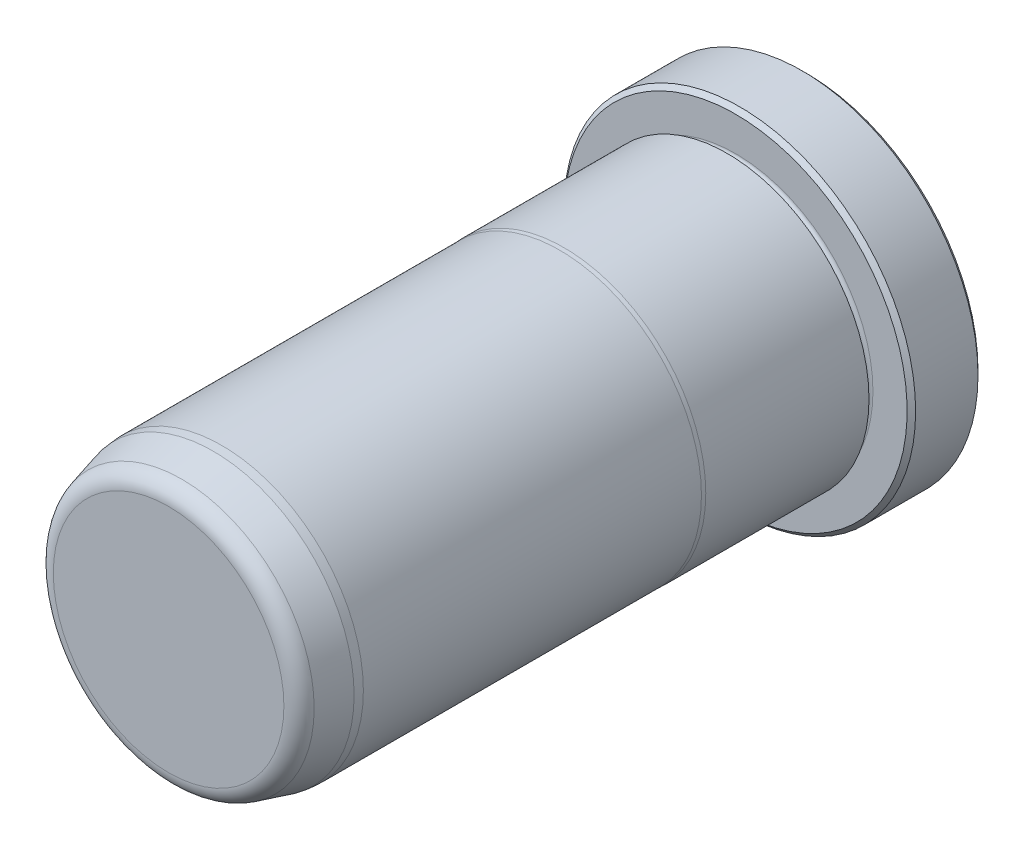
SolidWorks part; units mm, degrees
ref_plane "Front Plane" through (0, 0, 0) normal (0, 0, 1) x (1, 0, 0)
ref_plane "Top Plane" through (0, 0, 0) normal (0, 1, 0) x (1, 0, 0)
ref_plane "Right Plane" through (0, 0, 0) normal (1, 0, 0) x (0, 0, -1)
sketch "Sketch1" plane through (0, 0, 0) normal (1, 0, 0) x (0, 0, -1)
  line L0 (0, 0) -> (0, 15.748)
  line L1 (0, 15.748) -> (-6.35, 15.748)
  line L2 (-6.35, 15.748) -> (-6.35, 12.3063)
  line L3 (-6.35, 11.9253) -> (-7.112, 11.9253) construction
  line L4 (-7.112, 12.3063) -> (-7.112, 12.7127)
  line L5 (-7.112, 12.7127) -> (-21.7348, 12.7127)
  line L6 (-21.7348, 12.7127) -> (-22.098, 12.6873)
  line L7 (-22.098, 12.6873) -> (-52.3875, 12.6873)
  line L9 (-57.15, 11.5487) -> (-57.15, 0)
  line L10 (-57.15, 0) -> (0, 0)
  line L11 (0, 0) -> (13.6287, 0) construction
  line L12 (-52.3875, 12.6873) -> (-53.1495, 12.6206)
  line L13 (-53.1495, 12.6206) -> (-57.15, 11.5487)
  arc A0 (-7.112, 12.3063) -> (-6.35, 12.3063) centre (-6.731, 12.3063) ccw
  dimension "D14" = 0.762
  dimension "D1" = 6.35
  dimension "D2" = 0.762
  dimension "D3" = 31.496
  dimension "D4" = 25.4254
  dimension "D5" = 22.098
  dimension "D6" = 57.15
  dimension "D7" = 0.7874
  dimension "D8" = 4
  dimension "D9" = 25.3746
  dimension "D10" = 5
  dimension "D11" = 15
  dimension "D12" = 0.762
  dimension "D13" = 4.7625
revolve "Revolve1" add sketch "Sketch1" angle 360 about L11
fillet "Fillet6" radius 1.5875 1 edges at (11.5487, 0, 57.15)
chamfer "Chamfer1" distance 0.381 angle 45 2 edges at (15.748, 0, 0) (15.748, 0, 6.35)
